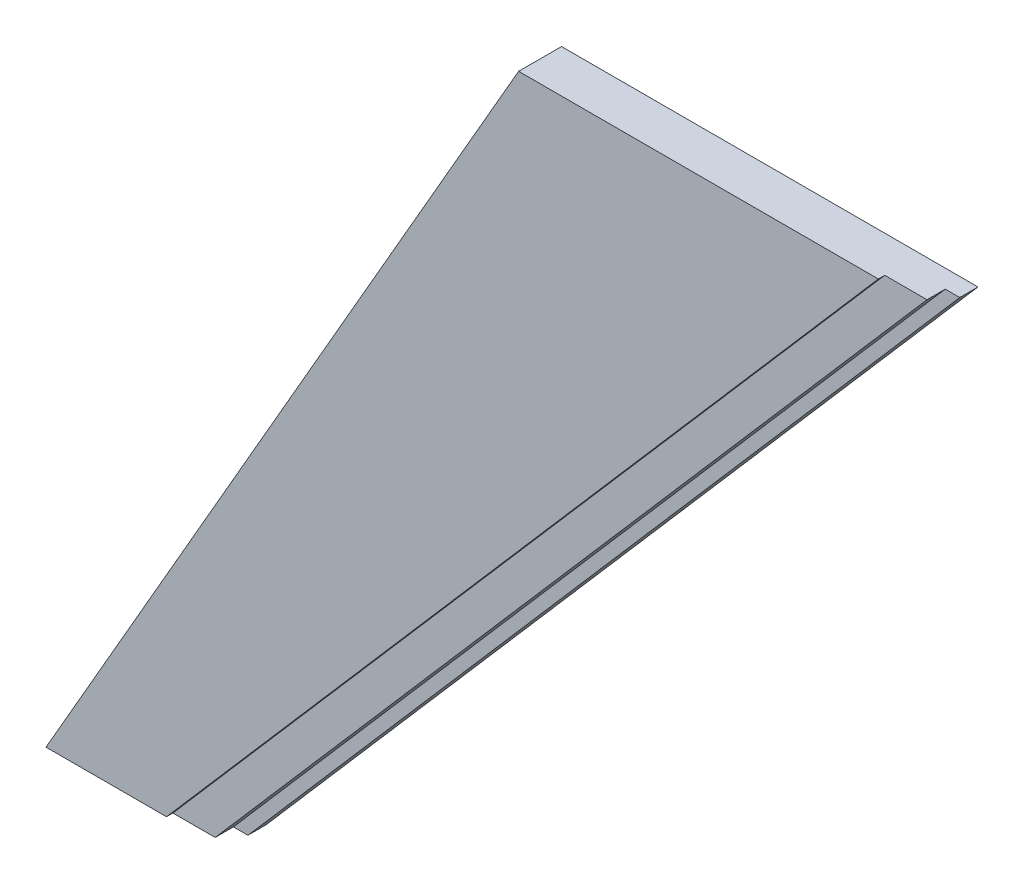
SolidWorks part; units mm, degrees
ref_plane "Спереди" through (0, 0, 0) normal (0, 0, 1) x (1, 0, 0)
ref_plane "Сверху" through (0, 0, 0) normal (0, 1, 0) x (1, 0, 0)
ref_plane "Справа" through (0, 0, 0) normal (1, 0, 0) x (0, 0, -1)
sketch "Эскиз1" plane through (0, 0, 0) normal (0, 0, 1) x (1, 0, 0)
  line L0 (-226.7832, 0) -> (-620.7803, 0)
  line L5 (-1138.4871, -900) -> (-1006.4871, -900)
  line L17 (-226.7832, 0) -> (-1006.4871, -900)
  line L19 (-620.7803, 0) -> (-1138.4871, -900)
extrude "Вытянуть1" add sketch "Эскиз1" along normal blind 47
sketch "Эскиз2" plane through (0, 0, 0) normal (0, 0, -1) x (-1, 0, 0)
  line L0 (226.7832, 0) -> (180.4754, 0)
  line L1 (1006.4871, -900) -> (960.1793, -900)
  line L2 (960.1793, -900) -> (180.4754, 0)
  line L3 (1006.4871, -900) -> (226.7832, 0) construction
  line L8 (226.7832, 0) -> (1006.4871, -900)
  line L9 (1006.4871, -900) -> (1138.4871, -900)
  line L10 (1138.4871, -900) -> (620.7803, 0)
  line L11 (620.7803, 0) -> (226.7832, 0)
  line L12 (226.7832, 0) -> (1006.4871, -900)
  dimension "D1" = 35
  dimension "D2" = 0
extrude "Вытянуть2" add sketch "Эскиз2" against normal blind 40
sketch "Эскиз3" plane through (0, 0, 0) normal (0, 0, -1) x (-1, 0, 0)
  line L0 (180.4754, 0) -> (164.5985, 0)
  line L1 (960.1793, -900) -> (944.3023, -900)
  line L2 (944.3023, -900) -> (164.5985, 0)
  line L3 (180.4754, 0) -> (960.1793, -900) construction
  line L8 (620.7803, 0) -> (180.4754, 0)
  line L9 (180.4754, 0) -> (960.1793, -900)
  line L10 (960.1793, -900) -> (1138.4871, -900)
  line L11 (1138.4871, -900) -> (620.7803, 0)
  line L13 (180.4754, 0) -> (960.1793, -900)
  dimension "D1" = 12
  dimension "D2" = 0
extrude "Вытянуть3" add sketch "Эскиз3" against normal blind 20
